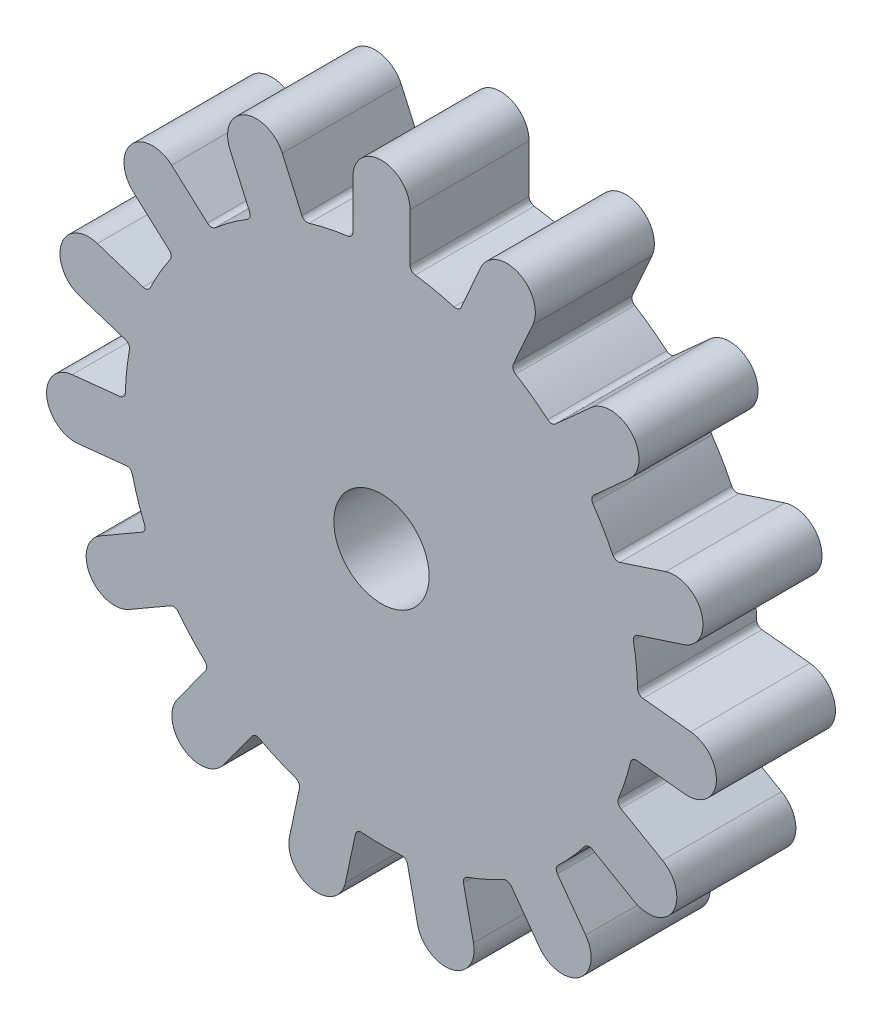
SolidWorks part; units mm, degrees
ref_plane "Front Plane" through (0, 0, 0) normal (0, 0, 1) x (1, 0, 0)
ref_plane "Top Plane" through (0, 0, 0) normal (0, 1, 0) x (1, 0, 0)
ref_plane "Right Plane" through (0, 0, 0) normal (1, 0, 0) x (0, 0, -1)
sketch "Sketch1" plane through (0, 0, 0) normal (0, 0, 1) x (1, 0, 0)
  line L1 (-2.4, 25.875) -> (-2.4, 21.8332)
  line L2 (2.4, 25.875) -> (2.4, 21.8332)
  line L3 (8.3318, 24.6142) -> (6.6879, 20.9218)
  line L4 (12.7168, 22.6618) -> (11.0729, 18.9695)
  line L5 (17.623, 19.0973) -> (14.6194, 16.3928)
  line L6 (20.8348, 15.5302) -> (17.8312, 12.8257)
  line L7 (23.8669, 10.2784) -> (20.023, 9.0294)
  line L8 (25.3502, 5.7133) -> (21.5063, 4.4643)
  line L9 (25.9841, -0.3178) -> (21.9645, 0.1047)
  line L10 (25.4824, -5.0915) -> (21.4628, -4.669)
  line L11 (23.6084, -10.859) -> (20.1081, -8.8382)
  line L12 (21.2084, -15.016) -> (17.7081, -12.9951)
  line L13 (17.1506, -19.5226) -> (14.7749, -16.2528)
  line L14 (13.2673, -22.344) -> (10.8916, -19.0742)
  line L15 (7.7273, -24.8106) -> (6.8869, -20.8571)
  line L16 (3.0322, -25.8086) -> (2.1918, -21.8551)
  line L17 (-3.0322, -25.8086) -> (-2.1918, -21.8551)
  line L18 (-7.7273, -24.8106) -> (-6.8869, -20.8571)
  line L19 (-13.2673, -22.344) -> (-10.8916, -19.0742)
  line L20 (-17.1506, -19.5226) -> (-14.7749, -16.2528)
  line L21 (-21.2084, -15.016) -> (-17.7081, -12.9951)
  line L22 (-23.6084, -10.859) -> (-20.1081, -8.8382)
  line L23 (-25.4824, -5.0915) -> (-21.4628, -4.669)
  line L24 (-25.9841, -0.3178) -> (-21.9645, 0.1047)
  line L25 (-25.3502, 5.7133) -> (-21.5063, 4.4643)
  line L26 (-23.8669, 10.2784) -> (-20.023, 9.0294)
  line L27 (-20.8348, 15.5302) -> (-17.8312, 12.8257)
  line L28 (-17.623, 19.0973) -> (-14.6194, 16.3928)
  line L29 (-12.7168, 22.6618) -> (-11.0729, 18.9695)
  line L30 (-8.3318, 24.6142) -> (-6.6879, 20.9218)
  arc A0 (-11.2679, 18.3401) -> (-13.9605, 16.3838) centre (0, 0) ccw
  arc A1 (-2.8342, 21.3376) -> (-6.0896, 20.6456) centre (0, 0) ccw
  arc A2 (2.4, 25.875) -> (-2.4, 25.875) centre (0, 25.875) ccw
  arc A3 (2.4, 21.8332) -> (2.8342, 21.3376) centre (2.9, 21.8332) ccw
  arc A4 (-2.4, 21.8332) -> (-2.8342, 21.3376) centre (-2.9, 21.8332) cw
  arc A5 (12.7168, 22.6618) -> (8.3318, 24.6142) centre (10.5243, 23.638) ccw
  arc A6 (6.6879, 20.9218) -> (6.0896, 20.6456) centre (6.2311, 21.1252) cw
  arc A7 (11.0729, 18.9695) -> (11.2679, 18.3401) centre (11.5297, 18.7661) ccw
  arc A8 (20.8348, 15.5302) -> (17.623, 19.0973) centre (19.2289, 17.3138) ccw
  arc A9 (14.6194, 16.3928) -> (13.9605, 16.3838) centre (14.2848, 16.7644) cw
  arc A10 (17.8312, 12.8257) -> (17.7534, 12.1714) centre (18.1657, 12.4542) ccw
  arc A11 (25.3502, 5.7133) -> (23.8669, 10.2784) centre (24.6086, 7.9958) ccw
  arc A12 (20.023, 9.0294) -> (19.4175, 9.2891) centre (19.8685, 9.5049) cw
  arc A13 (21.5063, 4.4643) -> (21.1691, 3.8982) centre (21.6608, 3.9888) ccw
  arc A14 (25.4824, -5.0915) -> (25.9841, -0.3178) centre (25.7333, -2.7047) ccw
  arc A15 (21.9645, 0.1047) -> (21.517, 0.5883) centre (22.0168, 0.6019) cw
  arc A16 (21.4628, -4.669) -> (20.9245, -5.049) centre (21.4105, -5.1663) ccw
  arc A17 (21.2084, -15.016) -> (23.6084, -10.859) centre (22.4084, -12.9375) ccw
  arc A18 (20.1081, -8.8382) -> (19.896, -8.2143) centre (20.3581, -8.4051) cw
  arc A19 (17.7081, -12.9951) -> (17.0618, -13.1233) centre (17.4581, -13.4281) ccw
  arc A20 (13.2673, -22.344) -> (17.1506, -19.5226) centre (15.2089, -20.9333) ccw
  arc A21 (14.7749, -16.2528) -> (14.8348, -15.5966) centre (15.1794, -15.9589) cw
  arc A22 (10.8916, -19.0742) -> (10.249, -18.9284) centre (10.4871, -19.368) ccw
  arc A23 (3.0322, -25.8086) -> (7.7273, -24.8106) centre (5.3797, -25.3096) ccw
  arc A24 (6.8869, -20.8571) -> (7.2086, -20.2821) centre (7.376, -20.7532) cw
  arc A25 (2.1918, -21.8551) -> (1.6641, -21.4606) centre (1.7028, -21.9591) ccw
  arc A26 (-7.7273, -24.8106) -> (-3.0322, -25.8086) centre (-5.3797, -25.3096) ccw
  arc A27 (-2.1918, -21.8551) -> (-1.6641, -21.4606) centre (-1.7028, -21.9591) cw
  arc A28 (-6.8869, -20.8571) -> (-7.2086, -20.2821) centre (-7.376, -20.7532) ccw
  arc A29 (-17.1506, -19.5226) -> (-13.2673, -22.344) centre (-15.2089, -20.9333) ccw
  arc A30 (-10.8916, -19.0742) -> (-10.249, -18.9284) centre (-10.4871, -19.368) cw
  arc A31 (-14.7749, -16.2528) -> (-14.8348, -15.5966) centre (-15.1794, -15.9589) ccw
  arc A32 (-23.6084, -10.859) -> (-21.2084, -15.016) centre (-22.4084, -12.9375) ccw
  arc A33 (-17.7081, -12.9951) -> (-17.0618, -13.1233) centre (-17.4581, -13.4281) cw
  arc A34 (-20.1081, -8.8382) -> (-19.896, -8.2143) centre (-20.3581, -8.4051) ccw
  arc A35 (-25.9841, -0.3178) -> (-25.4824, -5.0915) centre (-25.7333, -2.7047) ccw
  arc A36 (-21.4628, -4.669) -> (-20.9245, -5.049) centre (-21.4105, -5.1663) cw
  arc A37 (-21.9645, 0.1047) -> (-21.517, 0.5883) centre (-22.0168, 0.6019) ccw
  arc A38 (-23.8669, 10.2784) -> (-25.3502, 5.7133) centre (-24.6086, 7.9958) ccw
  arc A39 (-21.5063, 4.4643) -> (-21.1691, 3.8982) centre (-21.6608, 3.9888) cw
  arc A40 (-20.023, 9.0294) -> (-19.4175, 9.2891) centre (-19.8685, 9.5049) ccw
  arc A41 (-17.623, 19.0973) -> (-20.8348, 15.5302) centre (-19.2289, 17.3138) ccw
  arc A42 (-17.8312, 12.8257) -> (-17.7534, 12.1714) centre (-18.1657, 12.4542) cw
  arc A43 (-14.6194, 16.3928) -> (-13.9605, 16.3838) centre (-14.2848, 16.7644) ccw
  arc A44 (-8.3318, 24.6142) -> (-12.7168, 22.6618) centre (-10.5243, 23.638) ccw
  arc A45 (-11.0729, 18.9695) -> (-11.2679, 18.3401) centre (-11.5297, 18.7661) cw
  arc A46 (-6.6879, 20.9218) -> (-6.0896, 20.6456) centre (-6.2311, 21.1252) ccw
  arc A47 (-17.7534, 12.1714) -> (-19.4175, 9.2891) centre (0, 0) ccw
  arc A48 (6.0896, 20.6456) -> (2.8342, 21.3376) centre (0, 0) ccw
  arc A49 (13.9605, 16.3838) -> (11.2679, 18.3401) centre (0, 0) ccw
  arc A50 (19.4175, 9.2891) -> (17.7534, 12.1714) centre (0, 0) ccw
  arc A51 (21.517, 0.5883) -> (21.1691, 3.8982) centre (0, 0) ccw
  arc A52 (19.896, -8.2143) -> (20.9245, -5.049) centre (0, 0) ccw
  arc A53 (14.8348, -15.5966) -> (17.0618, -13.1233) centre (0, 0) ccw
  arc A54 (7.2086, -20.2821) -> (10.249, -18.9284) centre (0, 0) ccw
  arc A55 (-1.6641, -21.4606) -> (1.6641, -21.4606) centre (0, 0) ccw
  arc A56 (-10.249, -18.9284) -> (-7.2086, -20.2821) centre (0, 0) ccw
  arc A57 (-17.0618, -13.1233) -> (-14.8348, -15.5966) centre (0, 0) ccw
  arc A58 (-20.9245, -5.049) -> (-19.896, -8.2143) centre (0, 0) ccw
  arc A59 (-21.1691, 3.8982) -> (-21.517, 0.5883) centre (0, 0) ccw
  circle A60 centre (0, 0) radius 4
  point P143 (0, 0)
  dimension "D1" = 8
  dimension "D2" = 43.05
  dimension "D3" = 4.8
  dimension "D4" = 0.5
  dimension "D5" = 15
extrude "Boss-Extrude1" add sketch "Sketch1" along normal blind 10
